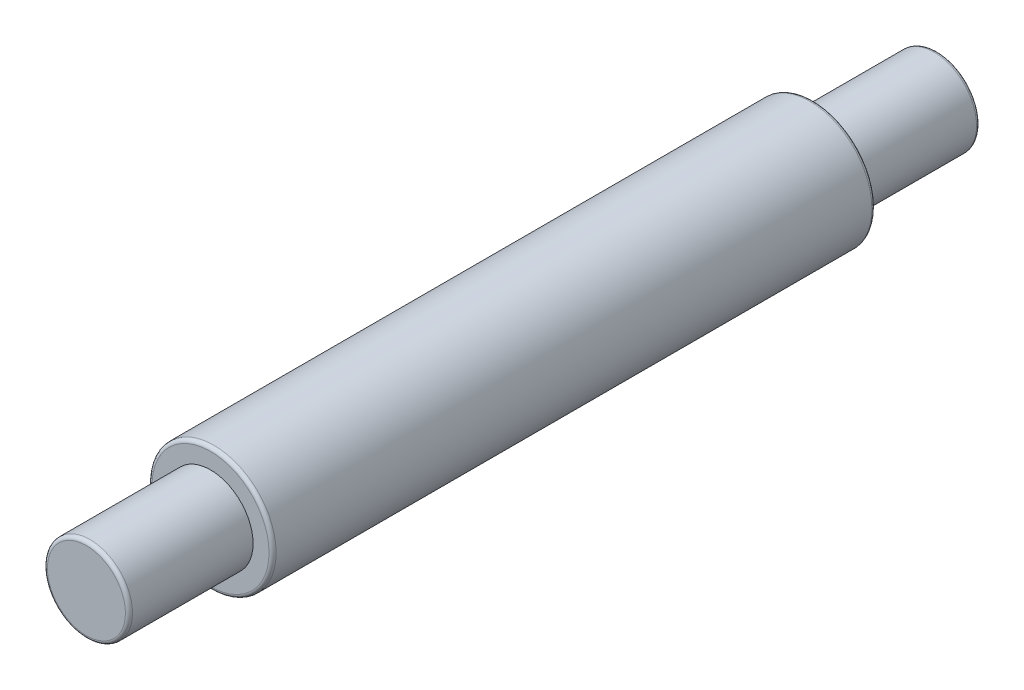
SolidWorks part; units mm, degrees
ref_plane "Piano frontale" through (0, 0, 0) normal (0, 0, 1) x (1, 0, 0)
ref_plane "Piano superiore" through (0, 0, 0) normal (0, 1, 0) x (1, 0, 0)
ref_plane "Piano destro" through (0, 0, 0) normal (1, 0, 0) x (0, 0, -1)
sketch "Schizzo1" plane through (0, 0, 0) normal (0, 0, 1) x (1, 0, 0)
  circle A0 centre (0, 0) radius 12
  dimension "D1" = 24
extrude "Estrusione-Estrusione1" add sketch "Schizzo1" along normal mid plane 240
fillet "Raccordo1" radius 1 2 edges at (12, 0, -120) (12, 0, 120)
sketch "Schizzo2" plane through (0, 0, 0) normal (0, 0, 1) x (1, 0, 0)
  circle A0 centre (0, 0) radius 12
  circle A1 centre (0, 0) radius 17.5
  circle A2 centre (0, 0) radius 12 construction
  dimension "D1" = 35
extrude "Estrusione-Estrusione2" add sketch "Schizzo2" along normal mid plane 170
fillet "Raccordo2" radius 1 2 edges at (17.5, 0, -85) (17.5, 0, 85)
sketch "Linee di piegatura1" [suppressed] plane through (0, 0, 0) normal (0, 1, 0) x (1, 0, 0)
sketch "Casella di contorno1" [suppressed] plane through (0, 0, 0) normal (0, 1, 0) x (1, 0, 0)
equation "\"Lam_vern\"= 2 * ( \"SW-Massa\" / \"SW-Densità\" ) / ( \"Spessore\" / 1000 )"
